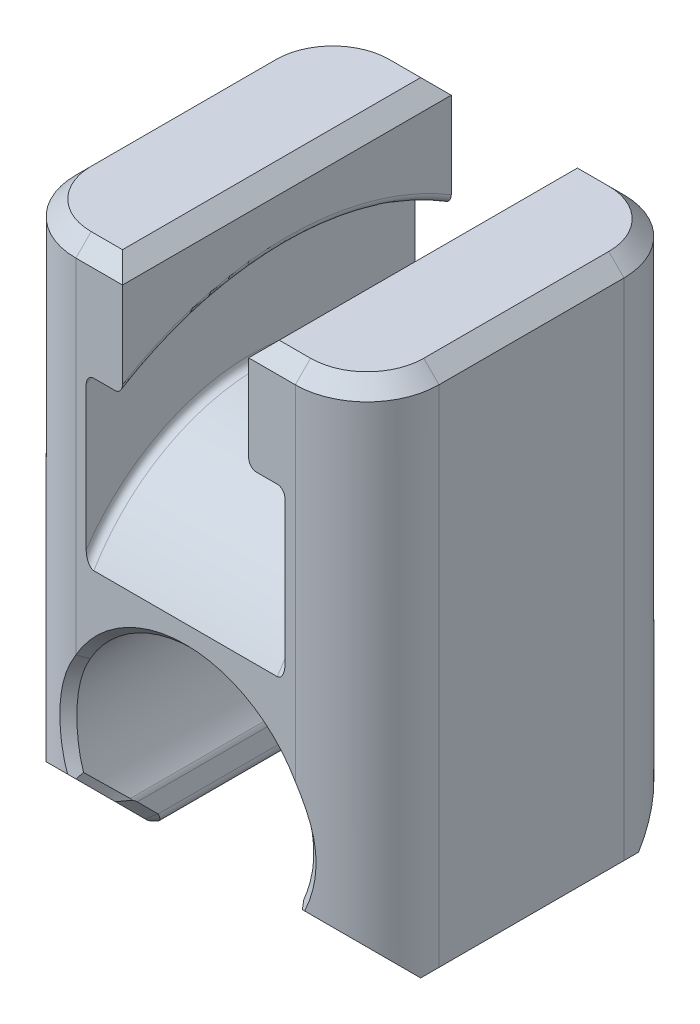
SolidWorks part; units mm, degrees
ref_plane "Front Plane" through (0, 0, 0) normal (0, 0, 1) x (1, 0, 0)
ref_plane "Top Plane" through (0, 0, 0) normal (0, 1, 0) x (1, 0, 0)
ref_plane "Right Plane" through (0, 0, 0) normal (1, 0, 0) x (0, 0, -1)
sketch "Sketch1" plane through (0, 0, 0) normal (1, 0, 0) x (0, 0, -1)
  line L0 (0, 0) -> (0, -5.334) construction
  line L1 (-5.461, -5.334) -> (5.461, -5.334)
  line L2 (-5.461, -5.334) -> (-5.461, 12.446)
  line L3 (-5.461, 12.446) -> (5.461, 12.446)
  line L4 (5.461, -5.334) -> (5.461, 12.446)
  dimension "D1" = 10.922
  dimension "D2" = 5.334
  dimension "D3" = 12.446
  dimension "D5" = 17.78
extrude "Extrude1" add sketch "Sketch1" along normal mid plane 12.065
sketch "Sketch2" plane through (0, 0, 0) normal (0, 0, 1) x (1, 0, 0)
  line L0 (0, -19.2503) -> (0, 19.2503) construction
  line L10 (0, 0) -> (-20.3314, 0) construction
  line L11 (2.0955, 17.4498) -> (2.0955, 10.3378)
  line L12 (2.0955, 10.3378) -> (3.302, 10.3378)
  line L13 (3.302, 10.3378) -> (3.302, 6.35)
  line L14 (3.302, 6.35) -> (-3.302, 6.35)
  line L15 (-3.302, 6.35) -> (-3.302, 10.3378)
  line L16 (-3.302, 10.3378) -> (-2.0955, 10.3378)
  line L17 (-2.0955, 10.3378) -> (-2.0955, 17.4498)
  line L18 (-2.0955, 17.4498) -> (2.0955, 17.4498)
  point P23 (2.6987, 10.3378)
  dimension "D5" = 4.191
  dimension "D8" = 6.604
  dimension "D9" = 6.35
  dimension "D10" = 10.3378
  dimension "D11" = 7.112
revolve "Cut-Revolve1" cut sketch "Sketch2" angle 180 mid plane about L10
fillet "Fillet1" radius 2.3876 4 edges at (6.0325, 3.556, -5.461) (6.0325, 3.556, 5.461) (-6.0325, 3.556, 5.461) (-6.0325, 3.556, -5.461)
fillet "Fillet3" radius 0.254 4 edges at (3.302, 6.35, 0) (3.302, 10.3378, 0) (-3.302, 6.35, 0) (-3.302, 10.3378, 0)
fillet "Fillet4" radius 0.254 2 edges at (-2.0955, 10.3378, 0) (2.0955, 10.3378, 0)
sketch "Sketch5" plane through (0, 0, 0) normal (0, 0, -1) x (-1, 0, 0)
  line L0 (3.048, -5.334) -> (-3.048, -5.334)
  line L1 (-3.6449, -5.334) -> (3.6449, -5.334) construction
  line L2 (-3.048, -5.334) -> (-3.048, -4.0413)
  line L4 (3.048, -4.0413) -> (3.048, -5.334)
  line L5 (0, -6.4116) -> (0, -1.5494) construction
  line L6 (0, 2.3876) -> (7.6462, 2.3876) construction
  arc A0 (3.048, -4.0413) -> (-3.048, -4.0413) centre (0, -1.5494) ccw
  dimension "D1" = 7.874
  dimension "D2" = 1.5494
  dimension "D3" = 6.096
  dimension "D4" = 0.9144
  dimension "D5" = 0.889
extrude "Cut-Extrude3" cut sketch "Sketch5" against normal through all both and the other way through all
sketch "Sketch7" plane through (0, 0, 0) normal (1, 0, 0) x (0, 0, 1)
  line L0 (-3.175, 5.334) -> (-5.461, 3.048)
  line L1 (5.461, 5.334) -> (3.0734, 5.334) construction
  line L2 (0, 0) -> (0, 6.4577) construction
  line L3 (0, 0) -> (6.8869, 0) construction
  line L4 (-3.175, 5.334) -> (-5.461, 5.334)
  line L5 (-5.461, 5.334) -> (-5.461, 3.048)
  line L6 (-5.461, 5.334) -> (-5.461, 3.0376) construction
  dimension "D1" = 45
  dimension "D2" = 2.286
extrude "Cut - remove" cut sketch "Sketch7" against normal through all both and the other way through all
mirror "Mirror2" about plane through (0, 0, 0) normal (0, 0, 1) of "Cut - remove"
fillet "Fillet5" radius 0.508 2 edges at (-3.048, -5.334, 0) (3.048, -5.334, 0)
chamfer "Chamfer2" distance 0.254 angle 45 7 edges at (3.9245, -1.2365, -5.4446) (-3.9245, -1.8623, -5.4446) (-3.6428, -3.0428, -5.461) (0, 2.3876, -5.461) (-3.9245, -1.2365, 5.4446) (3.9245, -1.8623, 5.4446) (0, 2.3876, 5.461)
chamfer "Chamfer3" distance 0.254 angle 45 16 edges at (3.048, -4.4337, -4.0753) (3.048, -4.4337, 4.0753) (-3.048, -4.4337, -4.0753) (-3.048, -4.4337, 4.0753) (4.7932, -5.334, -3.175) (3.1968, -5.1852, -3.3238) (4.7932, -5.334, 3.175) (3.1968, -5.1852, 3.3238) (-4.7932, -5.334, -3.175) (-3.1968, -5.1852, -3.3238) (-4.7932, -5.334, 3.175) (-3.1968, -5.1852, 3.3238)
chamfer "Chamfer4" distance 0.508 angle 45 2 edges at (6.0325, -5.334, 0) (-6.0325, -5.334, 0)
sketch "Sketch6" plane through (0, 0, 0) normal (0, 0, -1) x (-1, 0, 0)
  line L0 (-6.0325, -5.2275) -> (-4.0005, -5.334)
  line L1 (-6.0325, -4.826) -> (-6.0325, 12.446) construction
  line L2 (-6.0325, -5.2275) -> (-6.0325, -5.334)
  line L3 (-6.0325, -5.334) -> (-4.0005, -5.334)
  line L4 (-3.556, -5.334) -> (-5.5245, -5.334) construction
  dimension "D1" = 3
  dimension "D2" = 2.032
extrude "Cut-Extrude4" cut sketch "Sketch6" against normal through all both and the other way through all
mirror "Mirror1" about plane through (0, 0, 0) normal (1, 0, 0) of "Cut-Extrude4"
chamfer "Chamfer5" distance 0.508 angle 45 12 edges at (-5.3332, 12.446, -4.7617) (-2.8702, 12.446, -5.461) (2.8702, 12.446, -5.461) (2.0955, 12.446, 0) (2.8702, 12.446, 5.461) (-2.8702, 12.446, 5.461) (-5.3332, 12.446, 4.7617) (-6.0325, 12.446, 0) (5.3332, 12.446, 4.7617) (-2.0955, 12.446, 0) (5.3332, 12.446, -4.7617) (6.0325, 12.446, 0)
sketch "Sketch8" plane through (0, 0, 0) normal (1, 0, 0) x (0, 0, -1)
  line L7 (2.286, 2.3876) -> (2.794, 1.786) construction
  line L8 (5.461, 11.938) -> (5.461, 0.5192) construction
  line L9 (5.207, 2.3876) -> (-5.207, 2.3876) construction
  line L10 (2.794, 3.6208) -> (2.794, 0.4121) construction
  line L11 (2.794, 2.1336) -> (2.286, 2.1336)
  line L12 (2.286, 2.1336) -> (2.286, 2.6416)
  line L13 (2.286, 2.6416) -> (2.794, 2.6416)
  line L14 (2.794, 2.6416) -> (2.794, 2.1336)
  circle A0 centre (2.794, 1.786) radius 0.7874 construction
  dimension "D1" = 1.5748
  dimension "D7" = 0.1858
  dimension "D2" = 90
  dimension "D3" = 2.667
  dimension "D4" = 1.016
  dimension "D5" = 0.254
  dimension "D6" = 0.254
revolve "Cut-Revolve2" cut sketch "Sketch8" angle 360 about L10
sketch "Sketch9" plane through (0, 0, 0) normal (1, 0, 0) x (0, 0, -1)
  line L3 (0, 0) -> (0, 9.0135) construction
  line L4 (-1.0577, 6.2613) -> (-0.6041, 6.9049) construction
  line L5 (0, 0) -> (-0.6041, 6.9049) construction
  line L6 (-0.5534, 6.3258) -> (-1.0595, 6.2816)
  line L7 (-1.0595, 6.2816) -> (-1.0374, 6.0285)
  line L8 (-1.0374, 6.0285) -> (-0.5313, 6.0728)
  line L9 (-0.5313, 6.0728) -> (-0.5534, 6.3258)
  arc A1 (5.461, 3.2404) -> (-5.461, 3.2404) centre (0, 0) ccw construction
  circle A2 centre (-0.6041, 6.9049) radius 0.7874 construction
  point P16 (-0.5355, 6.1205)
  dimension "D3" = 1.5748
  dimension "D6" = 0.2061
  dimension "D1" = 5
  dimension "D2" = 90
  dimension "D4" = 0.254
  dimension "D5" = 1.016
revolve "Cut-Revolve3" cut sketch "Sketch9" angle 360 about L5
pattern_circular "CirPattern1" count 2 every 5 about axis through (0, 0, 0) along (1, 0, 0) of "Cut-Revolve3"
fillet "Fillet6" radius 0.254 2 edges at (3.048, -4.0413, 0) (-3.048, -4.0413, 0)
